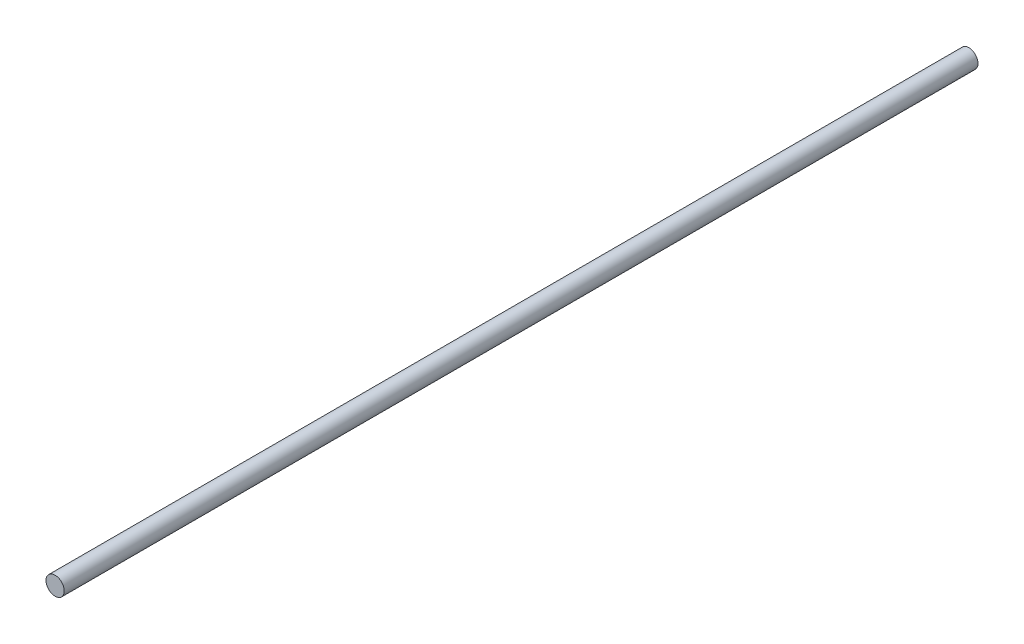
SolidWorks part; units mm, degrees
ref_plane "Front Plane" through (0, 0, 0) normal (0, 0, 1) x (1, 0, 0)
ref_plane "Top Plane" through (0, 0, 0) normal (0, 1, 0) x (1, 0, 0)
ref_plane "Right Plane" through (0, 0, 0) normal (1, 0, 0) x (0, 0, -1)
sketch "Sketch1" plane through (0, 0, 0) normal (0, 0, 1) x (1, 0, 0)
  circle A0 centre (0, 0) radius 30
  dimension "D1" = 60
extrude "Boss-Extrude1" add sketch "Sketch1" against normal blind 3000
